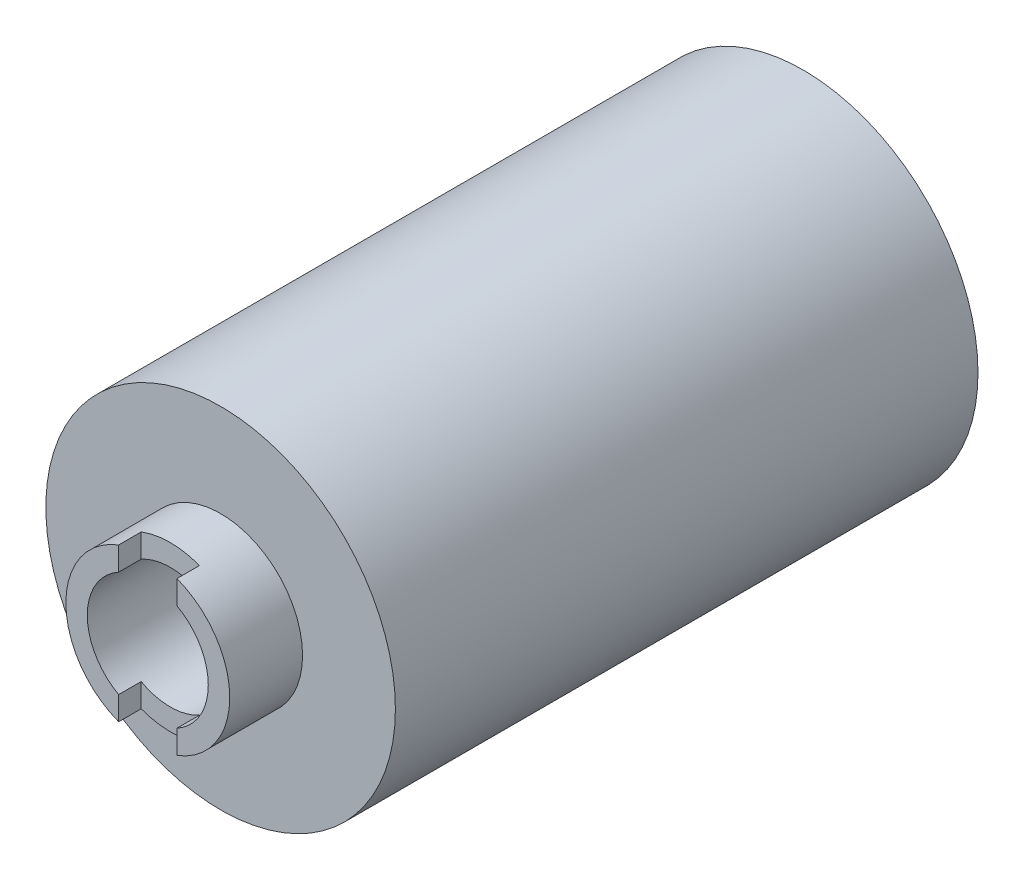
SolidWorks part; units mm, degrees
ref_plane "Plan de face" through (0, 0, 0) normal (0, 0, 1) x (1, 0, 0)
ref_plane "Plan de dessus" through (0, 0, 0) normal (0, 1, 0) x (1, 0, 0)
ref_plane "Plan de droite" through (0, 0, 0) normal (1, 0, 0) x (0, 0, -1)
sketch "Esquisse1" plane through (0, 0, 0) normal (0, 0, 1) x (1, 0, 0)
  circle A0 centre (0, 0) radius 60
  dimension "D1" = 120
extrude "Boss.-Extru.1" add sketch "Esquisse1" along normal blind 200
sketch "Esquisse2" plane through (0, 0, 200) normal (0, 0, 1) x (1, 0, 0)
  circle A0 centre (0, 0) radius 28.1293
extrude "Boss.-Extru.2" add sketch "Esquisse2" along normal blind 25
sketch "Esquisse3" plane through (0, 0, 225) normal (0, 0, 1) x (1, 0, 0)
  circle A0 centre (0, 0) radius 20.7636
extrude "Enlèv. mat.-Extru.1" cut sketch "Esquisse3" against normal through all
sketch "Esquisse4" plane through (0, 0, 0) normal (0, 1, 0) x (1, 0, 0)
  line L0 (0, 21.7247) -> (0, -289.1433) construction
  line L1 (10, -240.4784) -> (-10, -240.4784)
  line L2 (10, -240.4784) -> (10, -217.2632)
  line L3 (10, -217.2632) -> (-10, -217.2632)
  line L4 (-10, -240.4784) -> (-10, -217.2632)
  dimension "D1" = 20
  dimension "D2" = 10
extrude "Enlèv. mat.-Extru.2" cut sketch "Esquisse4" against normal through all both and the other way through all
